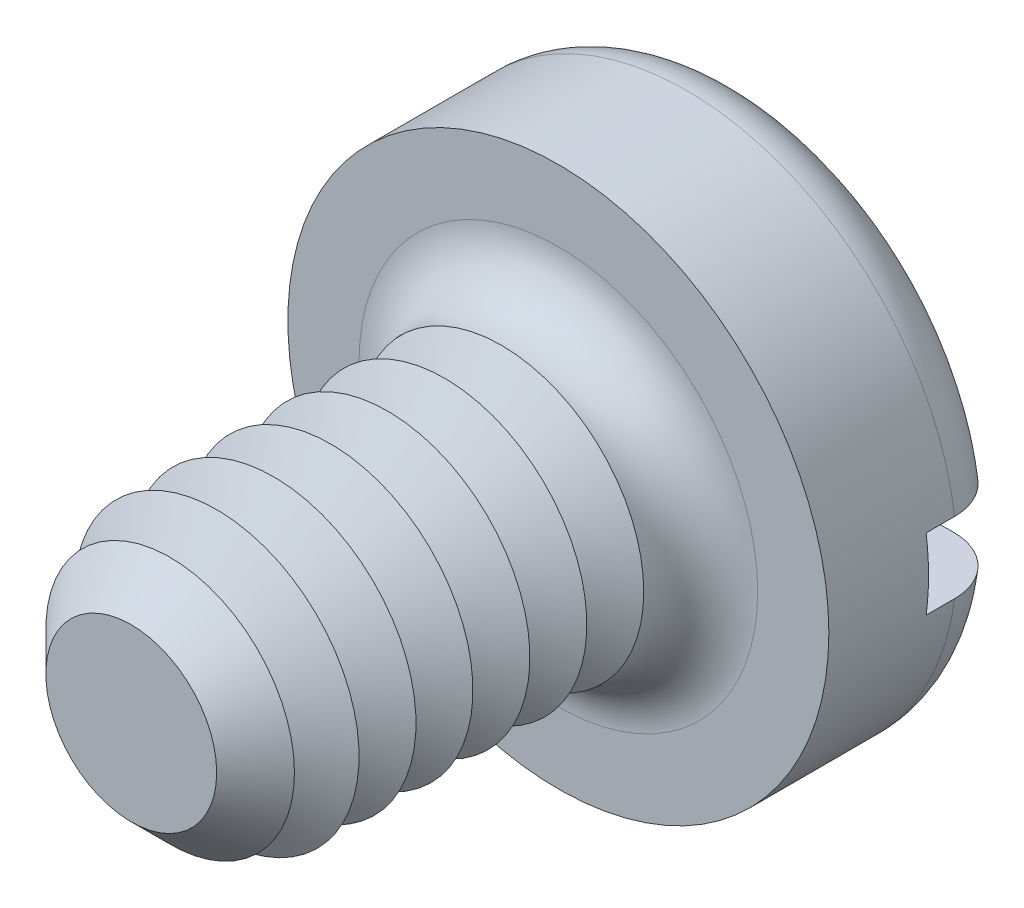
SolidWorks part; units mm, degrees
ref_plane "Front Plane" through (0, 0, 0) normal (0, 0, 1) x (1, 0, 0)
ref_plane "Top Plane" through (0, 0, 0) normal (0, 1, 0) x (1, 0, 0)
ref_plane "Right Plane" through (0, 0, 0) normal (1, 0, 0) x (0, 0, -1)
sketch "Sketch3" plane through (0, 0, 0) normal (0, 0, 1) x (1, 0, 0)
  circle A0 centre (0, 0) radius 1.9
  dimension "D1" = 3.8
extrude "Boss-Extrude2" add sketch "Sketch3" against normal blind 1.3
sketch "Sketch4" plane through (0, 0, 0) normal (0, 0, 1) x (1, 0, 0)
  circle A0 centre (0, 0) radius 1
  dimension "D1" = 2
extrude "Boss-Extrude3" add sketch "Sketch4" along normal blind 3
fillet "Fillet1" radius 0.4 2 edges at (1.9, 0, -1.3) (1, 0, 0)
chamfer "Chamfer1" distance 0.4 angle 45 1 edges at (1, 0, 3)
sketch "Sketch5" plane through (0, 0, 0) normal (1, 0, 0) x (0, 0, -1)
  line L0 (1.6944, 0) -> (-7.6738, 0) construction
sketch "Sketch6" plane through (0, 0, 0) normal (1, 0, 0) x (0, 0, -1)
  line L0 (-0.4, 1) -> (-0.6, 0.6536)
  line L1 (-0.6, 0.6536) -> (-0.8, 1)
  line L2 (-0.4, 1) -> (-2.6, 1) construction
  line L3 (-0.8, 1) -> (-0.4, 1)
  dimension "D1" = 0.4
revolve "Cut-Revolve1" cut sketch "Sketch6" angle 360 about L0
pattern_linear "LPattern1" count 6 spacing 0.4 along (0, 0, 1) of "Cut-Revolve1"
sketch "Sketch8" plane through (0, 0, -1.3) normal (0, 0, -1) x (-1, 0, 0)
  line L1 (1.9, -0.25) -> (-1.9, -0.25)
  line L2 (1.9, -0.25) -> (1.9, 0.25)
  line L3 (1.9, 0.25) -> (-1.9, 0.25)
  line L4 (-1.9, -0.25) -> (-1.9, 0.25)
  line L5 (1.9, -0.25) -> (-1.9, 0.25) construction
  line L6 (1.9, 0.25) -> (-1.9, -0.25) construction
  point P0 (0, 0)
  dimension "D1" = 3.8
  dimension "D2" = 0.5
extrude "Cut-Extrude1" cut sketch "Sketch8" against normal blind 0.6
